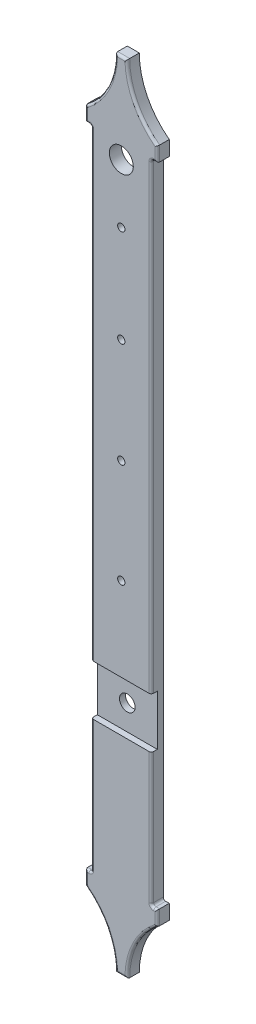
SolidWorks part; units mm, degrees
ref_plane "Front Plane" through (0, 0, 0) normal (0, 0, 1) x (1, 0, 0)
ref_plane "Top Plane" through (0, 0, 0) normal (0, 1, 0) x (1, 0, 0)
ref_plane "Right Plane" through (0, 0, 0) normal (1, 0, 0) x (0, 0, -1)
sketch "Sketch1" plane through (0, 0, 0) normal (0, 0, 1) x (1, 0, 0)
  line L0 (30, 269.7) -> (25, 269.7)
  line L1 (-25, -269.7) -> (-25, 269.7)
  line L2 (30, 269.7) -> (30, 282)
  line L3 (-5.01, 332) -> (5.01, 332)
  line L4 (-30, 269.7) -> (-30, 282)
  line L5 (-25, -269.7) -> (-30, -269.7)
  line L6 (-30, 0) -> (-30, 282) construction
  line L7 (-25, 269.7) -> (-30, 269.7)
  line L9 (25, -269.7) -> (25, 269.7)
  line L10 (-30, -269.7) -> (-30, -282)
  line L11 (-25, 0) -> (-25, 282) construction
  line L12 (25, 0) -> (25, 282) construction
  line L13 (30, 0) -> (30, 282) construction
  line L14 (-5.01, -332) -> (5.01, -332)
  line L15 (30, -269.7) -> (30, -282)
  line L16 (30, -269.7) -> (25, -269.7)
  arc A0 (5.01, 332) -> (30, 282) centre (67.51, 331.9925) ccw
  arc A1 (-5.01, 332) -> (-30, 282) centre (-67.51, 331.9925) cw
  arc A2 (-5.01, -332) -> (-30, -282) centre (-67.51, -331.9925) ccw
  arc A3 (5.01, -332) -> (30, -282) centre (67.51, -331.9925) cw
  point P0 (0, 0)
  point P11 (0, 332)
  point P31 (0, -332)
  dimension "D7" = 62.5
  dimension "D1" = 5
  dimension "D2" = 5
  dimension "D3" = 10.02
extrude "Boss-Extrude1" add sketch "Sketch1" along normal blind 10
fillet "Fillet1" radius 2 4 edges at (-25, -269.7, 5) (25, -269.7, 5) (25, 269.7, 5) (-25, 269.7, 5)
sketch "Sketch2" plane through (0, 0, 10) normal (0, 0, 1) x (1, 0, 0)
  line L0 (27, 269.7) -> (30, 269.7) construction
  circle A0 centre (0, 257.4) radius 10
  circle A1 centre (0, 208.4) radius 3.05
  circle A2 centre (0, 127.4) radius 3.05
  circle A3 centre (0, 40) radius 3.05
  circle A4 centre (0, -46.68) radius 3.05
  dimension "D1" = 20
  dimension "D3" = 6.1
  dimension "D4" = 6.1
  dimension "D7" = 6.1
  dimension "D8" = 6.1
  dimension "D2" = 12.3
  dimension "D5" = 49
  dimension "D6" = 81
  dimension "D9" = 87.4
  dimension "D10" = 86.68
extrude "Cut-Extrude1" cut sketch "Sketch2" against normal blind 55.3
fillet "Fillet2" radius 2 20 edges at (30, -275.85, 10) (11.6038, -304.0506, 10) (0, -332, 10) (-11.6038, -304.0506, 10) (-30, -275.85, 10) (-28.5, -269.7, 10) (-25.5858, -269.1142, 10) (-25.5858, 269.1142, 10) (-28.5, 269.7, 10) (-30, 275.85, 10) (-11.6038, 304.0506, 10) (0, 332, 10) (11.6038, 304.0506, 10) (30, 275.85, 10) (28.5, 269.7, 10) (25.5858, 269.1142, 10) (25, 0, 10) (25.5858, -269.1142, 10) (28.5, -269.7, 10) (-25, 0, 10)
sketch "Sketch3" plane through (0, 0, 10) normal (0, 0, 1) x (1, 0, 0)
  circle A0 centre (0, -137.5) radius 6.5
  circle A1 centre (0, -46.68) radius 3.05 construction
  dimension "D1" = 13
  dimension "D2" = 90.82
extrude "Cut-Extrude2" cut sketch "Sketch3" against normal blind 97
sketch "Sketch5" plane through (0, 0, 10) normal (0, 0, 1) x (1, 0, 0)
  line L0 (25, -116.5) -> (-25, -116.5)
  line L1 (25, 267.7) -> (25, -267.7) construction
  line L2 (-25, -267.7) -> (-25, 267.7) construction
  line L3 (25, -158.5) -> (-25, -158.5)
  line L4 (25, -116.5) -> (25, -158.5)
  line L5 (-25, -158.5) -> (-25, -116.5)
  circle A0 centre (0, -137.5) radius 6.5 construction
  dimension "D1" = 21
  dimension "D2" = 42
extrude "Cut-Extrude3" cut sketch "Sketch5" against normal blind 5
